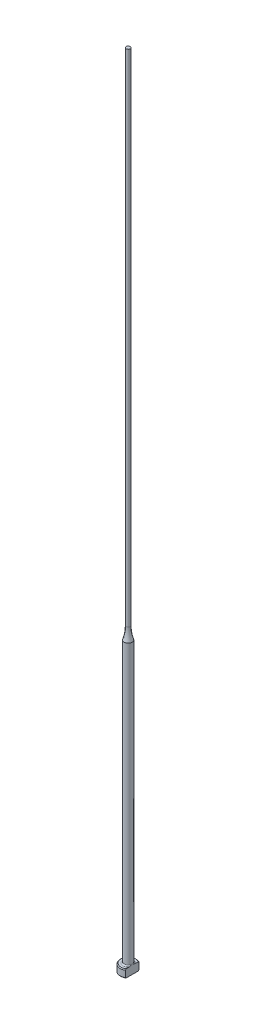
SolidWorks part; units mm, degrees
ref_plane "Front Plane" through (0, 0, 0) normal (0, 0, 1) x (1, 0, 0)
ref_plane "Top Plane" through (0, 0, 0) normal (0, 1, 0) x (1, 0, 0)
ref_plane "Right Plane" through (0, 0, 0) normal (1, 0, 0) x (0, 0, -1)
sketch "Sketch1" plane through (0, 0, 0) normal (0, 0, 1) x (1, 0, 0)
  line L0 (0, 259.9588) -> (0, -15.1925) construction
  line L1 (0, 0) -> (-2, 0)
  line L2 (-2, 0) -> (-2, 2)
  line L3 (-2, 2) -> (-1, 2)
  line L4 (-0.5, 75) -> (-0.5, 200)
  line L5 (-0.5, 200) -> (0, 200)
  line L6 (0, 200) -> (0, 0)
  line L7 (-1, 2) -> (-1, 71.8775)
  arc A0 (-1, 71.8775) -> (-0.5, 75) centre (-10.5, 75) ccw
  point P13 (-1, 0)
  dimension "D1" = 10
  dimension "L" = 200
  dimension "H" = 4
  dimension "T" = 2
  dimension "D" = 1
  dimension "B" = 2
  dimension "S" = 75
revolve "Revolve1" add sketch "Sketch1" angle 360 about L0
chamfer "Chamfer1" distance 0.2 angle 45 2 edges at (0, 2, 2) (0, 0, 2)
fillet "Fillet1" radius 0.3 1 edges at (0, 2, 1)
sketch "Sketch2" plane through (0, 0, 0) normal (0, 1, 0) x (1, 0, 0)
  line L0 (1, 1.7321) -> (1, -1.7321)
  circle A0 centre (0, 0) radius 2 construction
  arc A1 (1, -1.7321) -> (1, 1.7321) centre (0, 0) ccw
  circle A2 centre (0, 0) radius 1 construction
extrude "KEY" cut sketch "Sketch2" along normal through all
